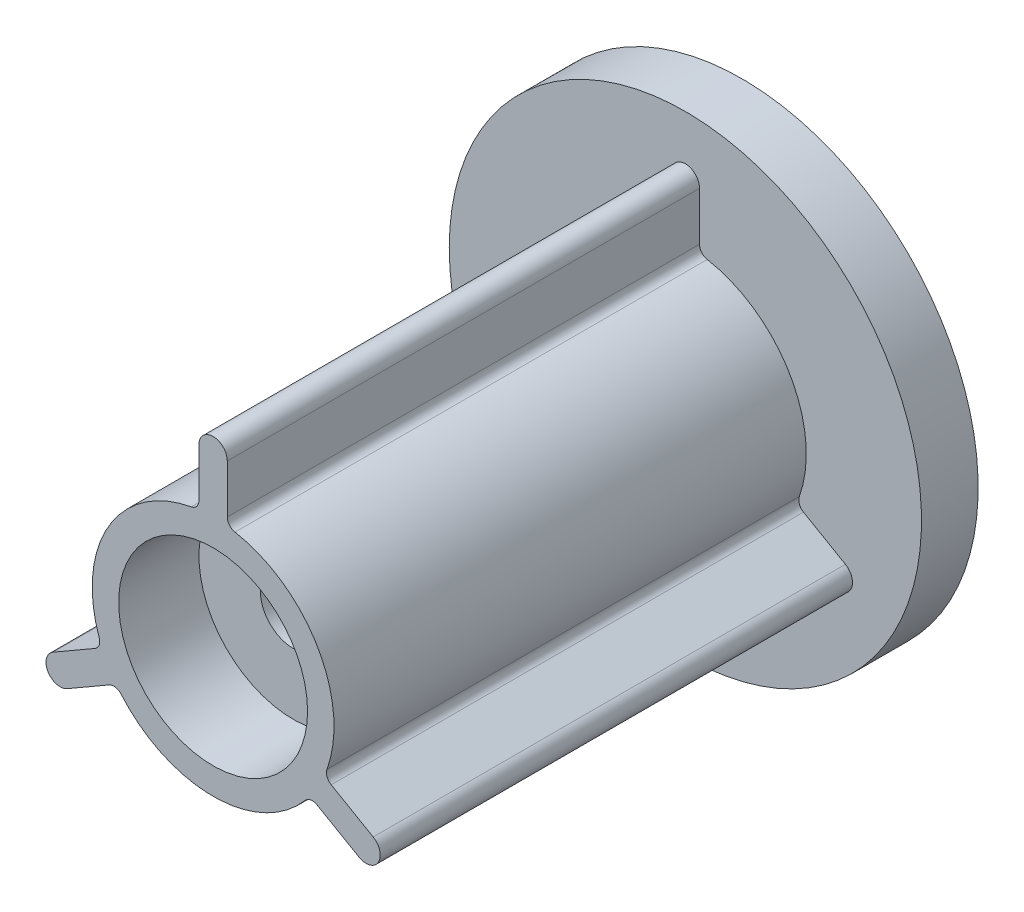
SolidWorks part; units mm, degrees
ref_plane "Front Plane" through (0, 0, 0) normal (0, 0, 1) x (1, 0, 0)
ref_plane "Top Plane" through (0, 0, 0) normal (0, 1, 0) x (1, 0, 0)
ref_plane "Right Plane" through (0, 0, 0) normal (1, 0, 0) x (0, 0, -1)
sketch "Sketch1" plane through (0, 0, 0) normal (0, 0, 1) x (1, 0, 0)
  line L0 (-0.75, 9.35) -> (-0.75, 6.3559)
  line L1 (0.75, 9.35) -> (0.75, 6.3559)
  line L2 (8.4723, -4.0255) -> (5.8794, -2.5284)
  line L3 (7.7223, -5.3245) -> (5.1294, -3.8275)
  line L4 (-7.7223, -5.3245) -> (-5.1294, -3.8275)
  line L5 (-8.4723, -4.0255) -> (-5.8794, -2.5284)
  circle A0 centre (0, 0) radius 10.1 construction
  arc A1 (-0.75, 6.3559) -> (-5.8794, -2.5284) centre (0, 0) ccw
  arc A2 (0.75, 9.35) -> (-0.75, 9.35) centre (0, 9.35) ccw
  arc A3 (7.7223, -5.3245) -> (8.4723, -4.0255) centre (8.0973, -4.675) ccw
  arc A4 (-8.4723, -4.0255) -> (-7.7223, -5.3245) centre (-8.0973, -4.675) ccw
  arc A5 (-5.1294, -3.8275) -> (5.1294, -3.8275) centre (0, 0) ccw
  arc A6 (5.8794, -2.5284) -> (0.75, 6.3559) centre (0, 0) ccw
  point P20 (0, 0)
  dimension "D1" = 20.2
  dimension "D2" = 12.8
  dimension "D3" = 1.5
  dimension "D4" = 3
extrude "Boss-Extrude1" add sketch "Sketch1" along normal mid plane 28 contours A1 L5 A4 L4 A5 L3 A3 L2 A6 L1 A2 L0
sketch "Sketch2" plane through (0, 0, -14) normal (0, 0, -1) x (-1, 0, 0)
  circle A0 centre (0, 0) radius 12.5
  dimension "D1" = 25
extrude "Boss-Extrude2" add sketch "Sketch2" against normal blind 3
sketch "Sketch3" plane through (0, 0, 14) normal (0, 0, 1) x (1, 0, 0)
  circle A0 centre (0, 0) radius 1.75
  dimension "D1" = 3.5
extrude "Cut-Extrude1" cut sketch "Sketch3" against normal through all
sketch "Sketch4" plane through (0, 0, 14) normal (0, 0, 1) x (1, 0, 0)
  circle A0 centre (0, 0) radius 5
  dimension "D1" = 10
extrude "Cut-Extrude2" cut sketch "Sketch4" against normal blind 4.25
mirror "Mirror1" about plane through (0, 0, 0) normal (0, 0, 1) of "Cut-Extrude2"
fillet "Fillet1" radius 0.5 6 edges at (-5.8794, -2.5284, 1.5) (-5.1294, -3.8275, 1.5) (5.1294, -3.8275, 1.5) (5.8794, -2.5284, 1.5) (0.75, 6.3559, 1.5) (-0.75, 6.3559, 1.5)
